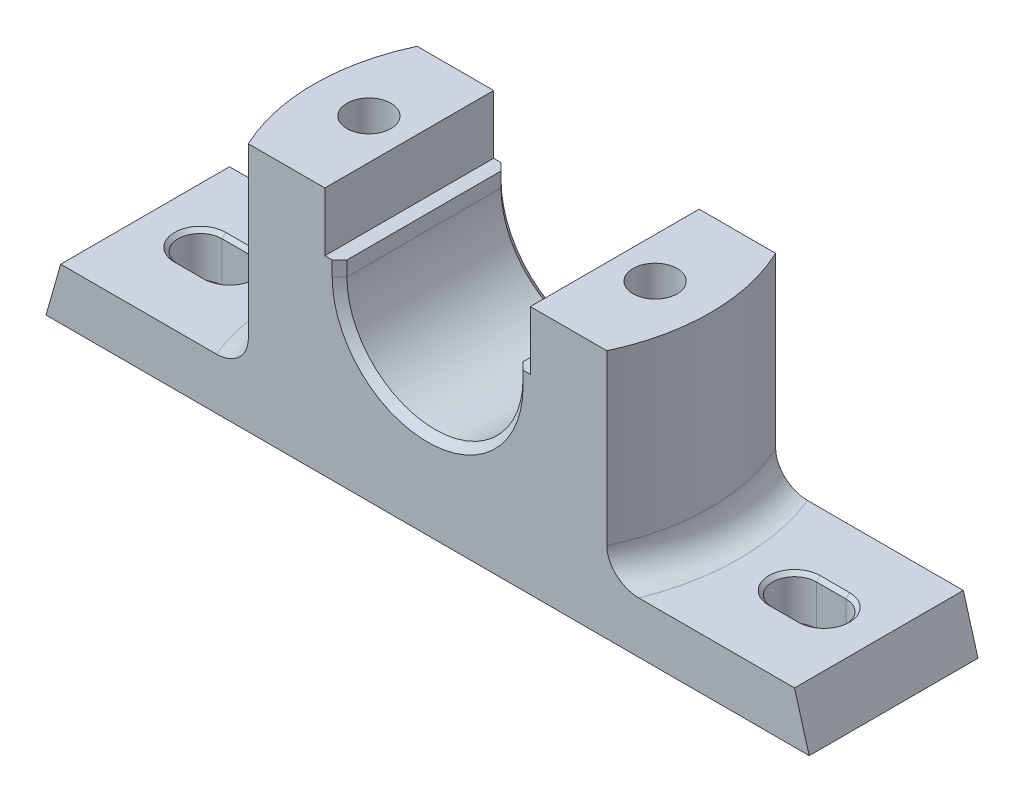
SolidWorks part; units mm, degrees
ref_plane "Front Plane" through (0, 0, 0) normal (0, 0, 1) x (1, 0, 0)
ref_plane "Top Plane" through (0, 0, 0) normal (0, 1, 0) x (1, 0, 0)
ref_plane "Right Plane" through (0, 0, 0) normal (1, 0, 0) x (0, 0, -1)
sketch "Sketch1" plane through (0, 0, 0) normal (0, 0, 1) x (1, 0, 0)
  line L0 (0, 67.1528) -> (0, 0) construction
  line L1 (-104, 0) -> (104, 0)
  line L2 (104, 0) -> (100, 14)
  line L3 (-104, 0) -> (-100, 14)
  line L4 (100, 14) -> (54, 14)
  line L5 (-100, 14) -> (-54, 14)
  line L6 (54, 14) -> (54, 68)
  line L7 (-54, 14) -> (-54, 68)
  line L8 (54, 68) -> (28, 68)
  line L9 (-54, 68) -> (-28, 68)
  line L10 (28, 68) -> (28, 52)
  line L11 (-28, 68) -> (-28, 52)
  line L12 (28, 52) -> (24, 52)
  line L13 (-28, 52) -> (-24, 52)
  line L14 (-24, 52) -> (-24, 48)
  line L16 (24, 52) -> (24, 48)
  arc A0 (-24, 48) -> (24, 48) centre (0, 48) ccw
  dimension "D6" = 16
  dimension "D8" = 48
  dimension "D1" = 208
  dimension "D2" = 14
  dimension "D3" = 4
  dimension "D4" = 54
  dimension "D5" = 56
  dimension "D7" = 68
  dimension "D9" = 4
extrude "Extrude1" add sketch "Sketch1" along normal mid plane 46
sketch "Sketch2" plane through (0, 68, 0) normal (0, 1, 0) x (1, 0, 0)
  line L0 (54, 23) -> (28, 23) construction
  line L1 (-48.8569, -23) -> (48.8569, -23)
  line L2 (-54, -23) -> (-54, 23) construction
  line L3 (-48.8569, 23) -> (48.8569, 23)
  line L5 (-48.8569, -23) -> (48.8569, 23) construction
  line L6 (-48.8569, 23) -> (48.8569, -23) construction
  arc A0 (-48.8569, 23) -> (-48.8569, -23) centre (0, 0) ccw
  arc A1 (48.8569, 23) -> (48.8569, -23) centre (0, 0) cw
  point P0 (0, 0)
extrude "Extrude2" cut sketch "Sketch2" against normal up to surface (54 mm away) flip side to cut
sketch "Sketch4" plane through (0, 0, 0) normal (0, -1, 0) x (1, 0, 0)
  line L1 (-97.5, -17.5) -> (97.5, -17.5)
  line L2 (-97.5, -17.5) -> (-97.5, 17.5)
  line L3 (-97.5, 17.5) -> (97.5, 17.5)
  line L4 (97.5, -17.5) -> (97.5, 17.5)
  line L5 (-97.5, -17.5) -> (97.5, 17.5) construction
  line L6 (-97.5, 17.5) -> (97.5, -17.5) construction
  point P0 (0, 0)
  dimension "D1" = 195
  dimension "D2" = 35
extrude "Extrude3" cut sketch "Sketch4" against normal blind 2
sketch "Sketch5" plane through (0, 2, 0) normal (0, -1, 0) x (1, 0, 0)
  line L0 (0, 14.9766) -> (0, -13) construction
  line L1 (-52, -13) -> (-26, -13)
  line L2 (-52, -13) -> (-52, 13)
  line L3 (-52, 13) -> (-26, 13)
  line L4 (-26, -13) -> (-26, 13)
  line L5 (-52, -13) -> (-26, 13) construction
  line L6 (-52, 13) -> (-26, -13) construction
  line L7 (26, -13) -> (52, -13)
  line L8 (26, -13) -> (26, 13)
  line L9 (26, 13) -> (52, 13)
  line L10 (52, -13) -> (52, 13)
  line L11 (26, -13) -> (52, 13) construction
  line L12 (26, 13) -> (52, -13) construction
  point P0 (-39, 0)
  point P5 (39, 0)
  dimension "D1" = 26
  dimension "D2" = 78
extrude "Extrude4" cut sketch "Sketch5" against normal blind 10
sketch "Sketch6" plane through (0, 68, 0) normal (0, 1, 0) x (1, 0, 0)
  point P0 (-39, 0)
  point P1 (39, 0)
  dimension "D1" = 78
  dimension "D2" = 39
other "Hole1"
sketch "Sketch8" plane through (0, 68, 0) normal (0, 1, 0) x (-1, 0, 0)
  circle A0 centre (39, 0) radius 6
  dimension "D1" = 12
other "Hole2"
sketch "Sketch9" plane through (0, 68, 0) normal (0, 1, 0) x (-1, 0, 0)
  circle A0 centre (-39, 0) radius 6
  dimension "D1" = 12
sketch "Sketch10" plane through (0, 14, 0) normal (0, 1, 0) x (1, 0, 0)
  line L0 (0, 0) -> (0, 41.3672) construction
  line L1 (-85, -6) -> (-77, -6)
  line L2 (85, 6) -> (77, -6) construction
  line L3 (-85, 6) -> (-77, 6)
  line L4 (85, -6) -> (77, 6) construction
  line L5 (-85, -6) -> (-77, 6) construction
  line L6 (-85, 6) -> (-77, -6) construction
  line L7 (85, 6) -> (77, 6)
  line L8 (85, -6) -> (77, -6)
  arc A0 (-85, 6) -> (-85, -6) centre (-85, 0) ccw
  arc A1 (-77, -6) -> (-77, 6) centre (-77, 0) ccw
  arc A2 (77, -6) -> (77, 6) centre (77, 0) cw
  arc A3 (85, 6) -> (85, -6) centre (85, 0) cw
  point P0 (-81, 0)
  point P13 (81, 0)
  dimension "D1" = 6
  dimension "D2" = 8
  dimension "D3" = 77
extrude "Extrude5" cut sketch "Sketch10" against normal through all
fillet "Fillet1" radius 8 2 edges at (-54, 14, 0) (54, 14, 0)
chamfer "Chamfer2" distance 1 angle 45 8 edges at (81, 14, 6) (91, 14, 0) (71, 14, 0) (81, 14, -6) (-81, 14, 6) (-71, 14, 0) (-91, 14, 0) (-81, 14, -6)
chamfer "Chamfer3" distance 2 angle 45 6 edges at (24, 50, -23) (-24, 50, -23) (0, 24, -23) (24, 50, 23) (-24, 50, 23) (0, 24, 23)
